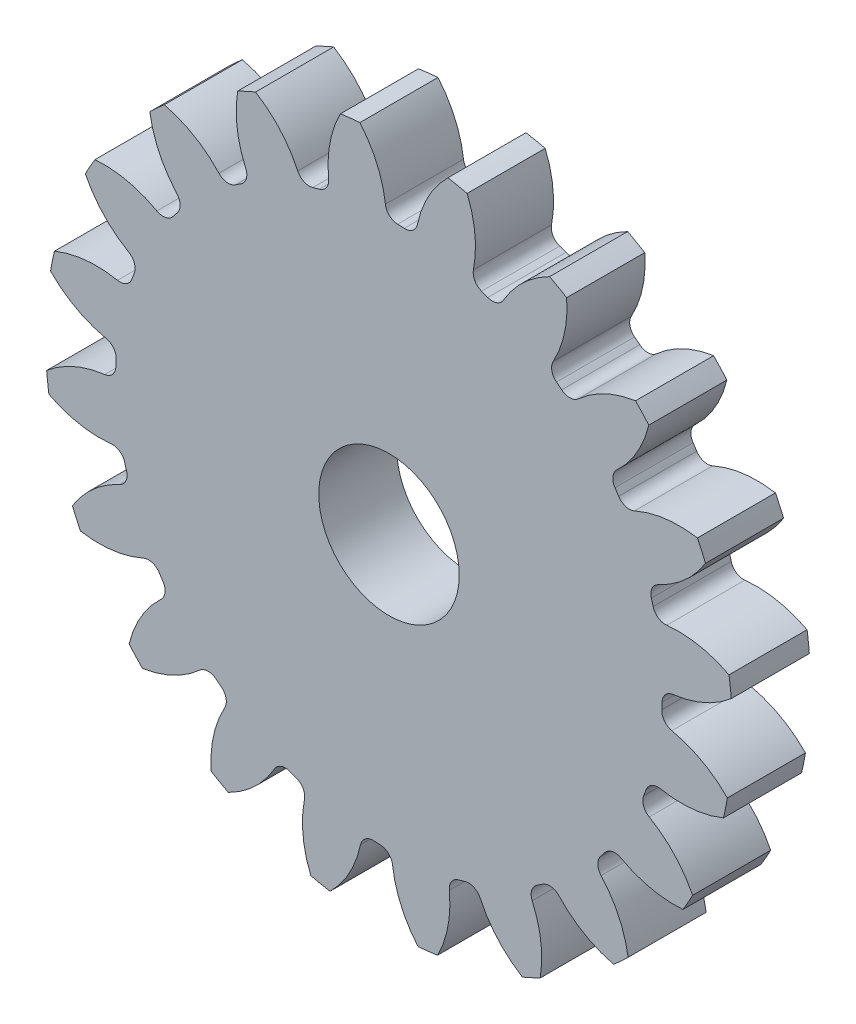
SolidWorks part; units mm, degrees
ref_plane "Front" through (0, 0, 0) normal (0, 0, 1) x (1, 0, 0)
ref_plane "Top" through (0, 0, 0) normal (0, 1, 0) x (1, 0, 0)
ref_plane "Right" through (0, 0, 0) normal (1, 0, 0) x (0, 0, -1)
sketch "Sketch3" plane through (0, 0, 0) normal (0, 0, 1) x (1, 0, 0)
  circle A0 centre (0, 0) radius 558.8
  dimension "od" = 1117.6
extrude "gearBody" add sketch "Sketch3" along normal blind 127
sketch "Sketch2" plane through (0, 0, 0) normal (0, 0, 1) x (1, 0, 0)
  line L0 (0, 0) -> (441.0267, 182.6792) construction
  line L1 (552.3612, -97.7325) -> (0, 0) construction
  line L2 (0, 0) -> (36.3143, 0) construction
  line L3 (507.7008, 17.4341) -> (504.2207, -61.8506) construction
  line L5 (505.9607, -22.2083) -> (0, 0) construction
  line L7 (0, 0) -> (477.3639, 0) construction
  arc A0 (477.2931, 8.2196) -> (474.7373, -50.0074) centre (0, 0) ccw construction
  arc A1 (556.8009, 47.2254) -> (550.5217, -95.8295) centre (0, 0) ccw construction
  arc A2 (507.7008, 17.4341) -> (504.2207, -61.8506) centre (0, 0) ccw construction
  arc A3 (443.8024, -24.8937) -> (444.2767, -14.0871) centre (0, 0) ccw
  arc A4 (552.3612, -97.7325) -> (460.1703, -46.2803) centre (423.3246, -220.6185) ccw
  arc A5 (552.3612, -97.7325) -> (558.8, 48.96) centre (0, 0) ccw
  arc A6 (558.8, 48.96) -> (462.4555, 5.7832) centre (441.0267, 182.6792) cw
  arc A7 (444.2767, -14.0871) -> (462.4555, 5.7832) centre (464.9419, -14.7423) cw
  arc A8 (460.1703, -46.2803) -> (443.8024, -24.8937) centre (464.4455, -26.0516) cw
  point P6 (558.8, 48.96)
  point P22 (552.3612, -97.7325)
  dimension "baseDia" = 954.7277
  dimension "od" = 1117.6
  dimension "pd" = 1016
  dimension "rd" = 889
  dimension "rFillet" = 20.6756
  dimension "pointX" = 558.8
  dimension "pointY" = 48.96
  dimension "CTT" = 79.2847
  dimension "flankCenterAngle" = 22.5
extrude "toothCut" cut sketch "Sketch2" along normal through all
pattern_circular "CirPattern1" count 20 over 360 about axis through (0, 0, 0) along (0, 0, 1) of "toothCut"
sketch "hub1Dia" plane through (0, 0, 0) normal (0, 0, -1) x (-1, 0, 0)
  circle A0 centre (0, 0) radius 12.7
  dimension "hub1Dia" = 25.4
sketch "hub2Dia" plane through (0, 0, 127) normal (0, 0, 1) x (1, 0, 0)
  circle A0 centre (0, 0) radius 12.7
  dimension "hub2dia" = 25.4
sketch "boreDia" plane through (0, 0, 0) normal (0, 0, 1) x (1, 0, 0)
  circle A0 centre (0, 0) radius 114.3
  dimension "boreDia" = 228.6
extrude "bore" cut sketch "boreDia" against normal mid plane 25400
